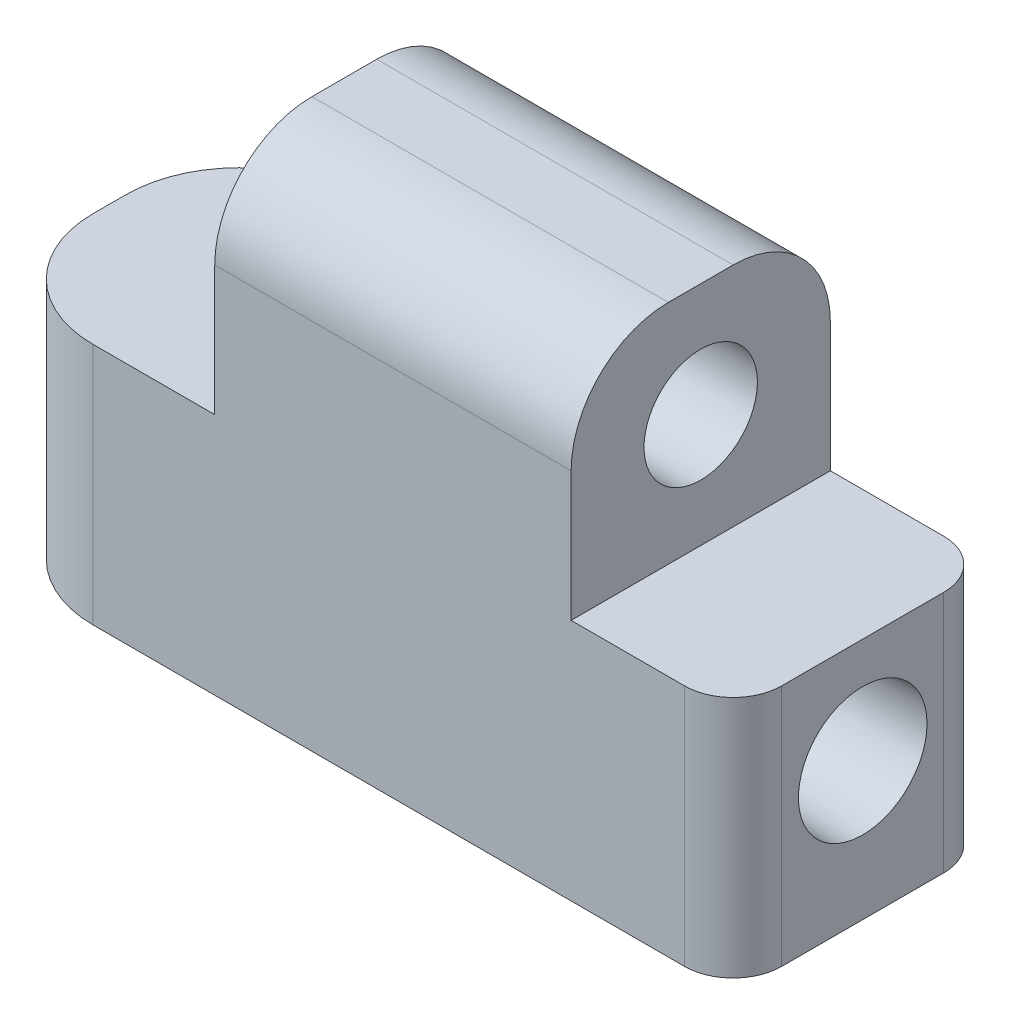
SolidWorks part; units mm, degrees
ref_plane "Front Plane" through (0, 0, 0) normal (0, 0, 1) x (1, 0, 0)
ref_plane "Top Plane" through (0, 0, 0) normal (0, 1, 0) x (1, 0, 0)
ref_plane "Right Plane" through (0, 0, 0) normal (1, 0, 0) x (0, 0, -1)
body saved out of another part "Stock-AAReST Propellant Tank Final-1"
